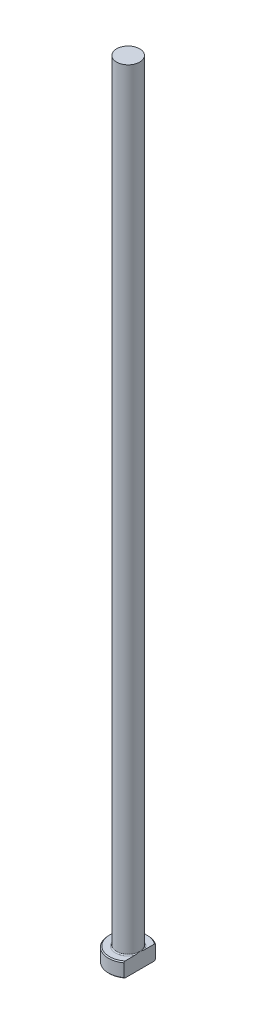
SolidWorks part; units mm, degrees
ref_plane "Front Plane" through (0, 0, 0) normal (0, 0, 1) x (1, 0, 0)
ref_plane "Top Plane" through (0, 0, 0) normal (0, 1, 0) x (1, 0, 0)
ref_plane "Right Plane" through (0, 0, 0) normal (1, 0, 0) x (0, 0, -1)
sketch "Sketch1" plane through (0, 0, 0) normal (0, 0, 1) x (1, 0, 0)
  line L0 (0, 259.9588) -> (0, -15.1925) construction
  line L1 (0, 0) -> (-4, 0)
  line L2 (-4, 0) -> (-4, 3)
  line L3 (-4, 3) -> (-2.35, 3)
  line L4 (-2.35, 3) -> (-2.35, 160)
  line L5 (-2.35, 160) -> (0, 160)
  line L6 (0, 160) -> (0, 0)
  dimension "L" = 160
  dimension "H" = 8
  dimension "T" = 3
  dimension "D" = 4.7
revolve "Revolve1" add sketch "Sketch1" angle 360 about L0
chamfer "Chamfer1" distance 0.2 angle 45 2 edges at (0, 3, 4) (0, 0, 4)
fillet "Fillet1" radius 0.2 1 edges at (0, 3, 2.35)
sketch "Sketch2" plane through (0, 0, 0) normal (0, 1, 0) x (1, 0, 0)
  line L0 (2.35, 3.2369) -> (2.35, -3.2369)
  circle A0 centre (0, 0) radius 4 construction
  arc A1 (2.35, -3.2369) -> (2.35, 3.2369) centre (0, 0) ccw
  circle A2 centre (0, 0) radius 2.35 construction
extrude "KEY" cut sketch "Sketch2" along normal through all
